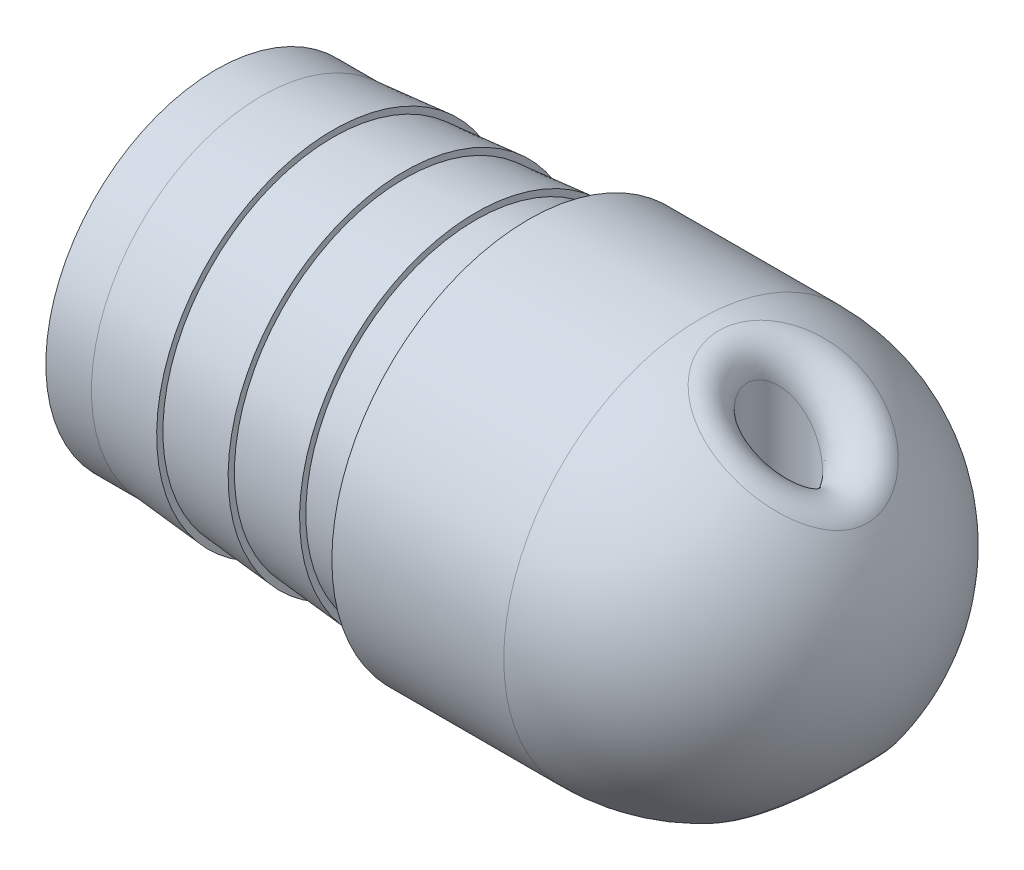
SolidWorks part; units mm, degrees
ref_plane "Front Plane" through (0, 0, 0) normal (0, 0, 1) x (1, 0, 0)
ref_plane "Top Plane" through (0, 0, 0) normal (0, 1, 0) x (1, 0, 0)
ref_plane "Right Plane" through (0, 0, 0) normal (1, 0, 0) x (0, 0, -1)
sketch "Sketch0" plane through (0, 0, 0) normal (0, 0, 1) x (1, 0, 0)
  line L0 (-9.525, 0) -> (-41.275, 0) construction
  line L1 (-41.275, 12.6365) -> (-41.275, -12.6365) construction
  line L2 (-9.525, 17.907) -> (-9.525, -17.907) construction
  line L3 (-9.525, 17.272) -> (-9.525, -17.272) construction
  line L4 (-9.525, 0) -> (0, 0) construction
  line L20 (0, 0) -> (0, 9.525) construction
  circle A0 centre (0, 0) radius 19.9644 construction
  point P19 (0, 19.9644)
  dimension "Pipe OD" = 39.9288
  dimension "P" = 31.75
  dimension "D" = 25.273
  dimension "Z" = 35.814
  dimension "V" = 0.635
  dimension "H" = 41.275
  dimension "G" = 9.525
  dimension "L" = 41.275
sketch "Sketch1" plane through (0, 0, 0) normal (0, 0, 1) x (1, 0, 0)
  line L0 (-41.275, 12.6365) -> (-9.525, 12.6365)
  line L1 (-9.525, 17.907) -> (-9.525, -17.907) construction
  line L2 (-9.525, 12.6365) -> (-9.525, 17.272)
  line L3 (-36.6395, 17.272) -> (-41.275, 17.272)
  line L4 (-41.275, 17.272) -> (-41.275, 12.6365)
  line L5 (-36.6395, 17.272) -> (-29.3814, 17.907)
  line L6 (-29.3814, 17.907) -> (-7.6072, 17.907) construction
  line L7 (-9.525, 17.272) -> (-7.6072, 17.272)
  line L8 (-36.6395, 17.272) -> (-7.6072, 17.272) construction
  line L9 (-29.3814, 17.907) -> (-29.3814, 17.272)
  line L10 (-29.3814, 17.272) -> (-22.1233, 17.907)
  line L11 (-22.1233, 17.907) -> (-22.1233, 17.272)
  line L12 (-22.1233, 17.272) -> (-14.8653, 17.907)
  line L13 (-14.8653, 17.907) -> (-14.8653, 17.272)
  line L14 (-14.8653, 17.272) -> (-7.6072, 17.907)
  line L15 (-7.6072, 17.907) -> (-7.6072, 17.272)
  line L16 (-7.6072, 17.907) -> (-9.525, 17.907) construction
  line L17 (-41.275, 0) -> (-9.525, 0) construction
  line L18 (-41.275, 17.907) -> (-41.275, -17.907) construction
  dimension "D1" = 5
revolve "Revolve1" add sketch "Sketch1" angle 360 about L17
sketch "Sketch2" plane through (-9.525, 0, 0) normal (1, 0, 0) x (0, 0, -1)
  circle A2 centre (0, 0) radius 19.9644
extrude "Boss-Extrude1" add sketch "Sketch2" along normal up to vertex
sketch "Sketch3" plane through (-41.275, 0, 0) normal (-1, 0, 0) x (0, 0, 1)
  circle A0 centre (0, 0) radius 17.907
  circle A1 centre (0, 0) radius 17.907 construction
  circle A2 centre (0, 0) radius 17.399
  dimension "D1" = 0.508
extrude "Cut-Extrude1" [suppressed] cut sketch "Sketch3" against normal up to surface (31.75 mm away)
hole_wizard "#25 (0.1495) Diameter Hole1" positions "Sketch4" profile "Sketch5" hole size "#25" standard "ANSI Inch"
sketch "Sketch4" plane through (0, 0, 0) normal (1, 0, 0) x (0, 0, -1)
  point P0 (0, 0)
sketch "Sketch5" plane through (0, 0, 0) normal (0, 1, 0) x (0, 0, -1)
  line L0 (0, 0) -> (0, 9.525)
  line L1 (0, 9.525) -> (1.8986, 9.525)
  line L2 (1.8986, 9.525) -> (1.8986, 0.635)
  line L3 (1.8986, 0.635) -> (2.5337, 0)
  line L5 (2.5337, 0) -> (0, 0)
  line L6 (-1.8986, 0.635) -> (-2.5337, 0) construction
  line L11 (0, -6.35) -> (0, 107.95) construction
  dimension "Thru Hole Dia." = 3.7973
  dimension "Thru Hole Depth" = 9.525
  dimension "Near C'Sink Dia." = 5.0673
  dimension "Near C'Sink Angle" = 90
sketch "Sketch6" plane through (0, 0, 0) normal (0, 1, 0) x (1, 0, 0)
  line L0 (0, -19.9644) -> (0, 19.9644) construction
  line L1 (7.9375, 19.9644) -> (7.9375, -19.9644) construction
  line L2 (7.9375, -19.9644) -> (0, -19.9644)
  line L3 (7.9375, 19.9644) -> (0, 19.9644) construction
  line L4 (0, 0) -> (0, -19.9644)
  line L6 (0, 0) -> (7.9375, 0)
  line L7 (7.9375, 0) -> (27.9019, 0)
  line L8 (-9.525, -19.9644) -> (0, -19.9644) construction
  line L11 (0, 19.9644) -> (0, 0) construction
  arc A1 (7.9375, 19.9644) -> (27.9019, 0) centre (7.9375, 0) cw construction
  arc A2 (27.9019, 0) -> (7.9375, -19.9644) centre (7.9375, 0) cw
  point P13 (26.8668, 1.6288)
  point P14 (0, 0)
  point P15 (27.7344, 6.6604)
  point P16 (27.7429, -0.2853)
  point P17 (0, -19.4817)
  point P18 (26.9875, -0.4462)
  point P21 (0, 0)
  point P22 (0, 0)
  dimension "D1" = 7.9375
revolve "Revolve3" add sketch "Sketch6" angle 360 about L7
sketch "Sketch9" plane through (0, 0, 0) normal (0, 1, 0) x (1, 0, 0)
  circle A0 centre (15.875, 0) radius 3.175
  dimension "D1" = 6.35
  dimension "D2" = 15.875
extrude "Cut-Extrude2" cut sketch "Sketch9" against normal through all both and the other way through all
fillet "Fillet4" radius 3.175 2 edges at (17.435, -17.3415, 2.7653) (18.5024, 16.8458, 1.7825)
